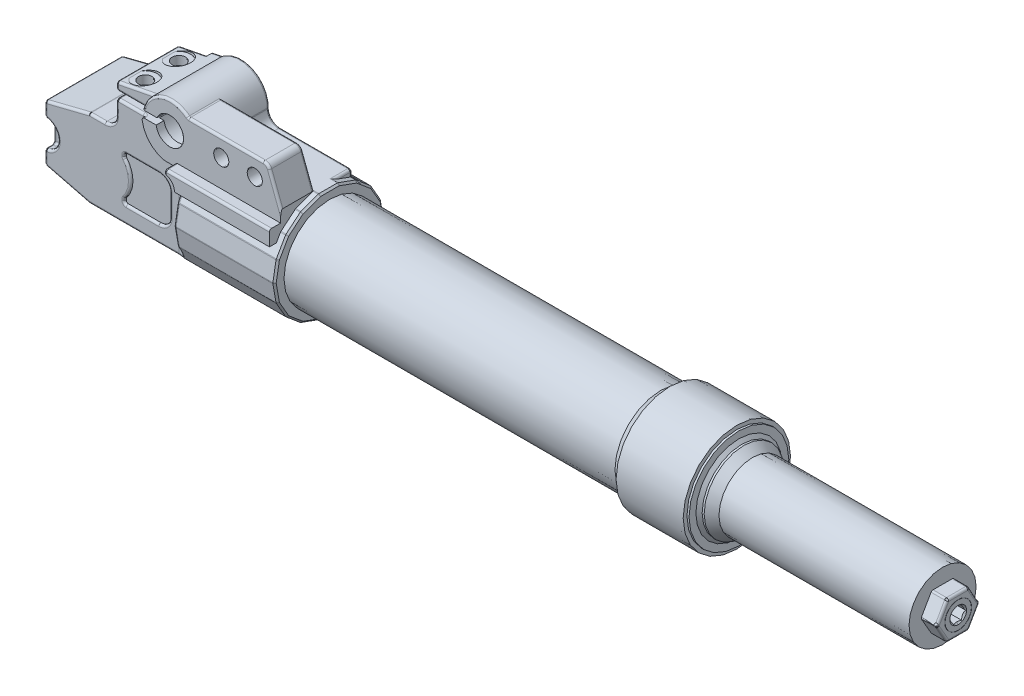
SolidWorks part; units mm, degrees
ref_plane "Plan de face" through (0, 0, 0) normal (0, 0, 1) x (1, 0, 0)
ref_plane "Plan de dessus" through (0, 0, 0) normal (0, 1, 0) x (1, 0, 0)
ref_plane "Plan de droite" through (0, 0, 0) normal (1, 0, 0) x (0, 0, -1)
imported_body "Importée2"
sketch "Esquisse2" plane through (0, 0, 4) normal (0, 0, -1) x (-1, 0, 0)
  arc A2 (81.9347, 30.1616) -> (88.6847, 30.1616) centre (85.3097, 30.1616) ccw construction
  arc A3 (88.6847, 30.1616) -> (81.9347, 30.1616) centre (85.3097, 30.1616) ccw construction
  arc A4 (103.6847, 30.1616) -> (96.9347, 30.1616) centre (100.3097, 30.1616) ccw construction
  arc A5 (96.9347, 30.1616) -> (103.6847, 30.1616) centre (100.3097, 30.1616) ccw construction
  arc A6 (81.9347, 30.1616) -> (88.6847, 30.1616) centre (85.3097, 30.1616) ccw
  arc A7 (88.6847, 30.1616) -> (81.9347, 30.1616) centre (85.3097, 30.1616) ccw
  arc A8 (103.6847, 30.1616) -> (96.9347, 30.1616) centre (100.3097, 30.1616) ccw
  arc A9 (96.9347, 30.1616) -> (103.6847, 30.1616) centre (100.3097, 30.1616) ccw
extrude "Boss.-Extru.1" add sketch "Esquisse2" against normal up to surface (15 mm away)
sketch "Esquisse3" plane through (0, 0, 4) normal (0, 0, -1) x (-1, 0, 0)
  line L0 (105.772, 24.374) -> (74.8419, 24.374) construction
  circle A0 centre (85.3097, 31.374) radius 3.4
  circle A1 centre (100.3097, 31.374) radius 3.4
  arc A2 (131.2464, 32.4137) -> (115.0597, 30.1616) centre (123.3097, 30.1616) ccw construction
  dimension "D1" = 7
  dimension "D3" = 23
  dimension "D4" = 6.8
  dimension "D2" = 15
extrude "Enlèv. mat.-Extru.1" cut sketch "Esquisse3" against normal through all
